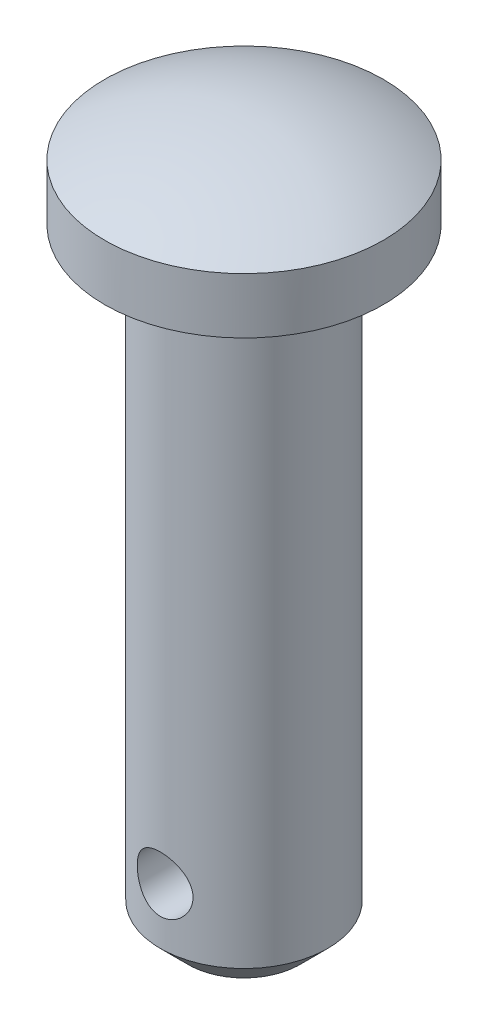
SolidWorks part; units mm, degrees
ref_plane "Front Plane" through (0, 0, 0) normal (0, 0, 1) x (1, 0, 0)
ref_plane "Top Plane" through (0, 0, 0) normal (0, 1, 0) x (1, 0, 0)
ref_plane "Right Plane" through (0, 0, 0) normal (1, 0, 0) x (0, 0, -1)
sketch "Sketch1" plane through (0, 0, 0) normal (0, 0, 1) x (1, 0, 0)
  line L0 (3.81, -4.2415) -> (6.35, -4.2415)
  line L1 (6.35, -4.2415) -> (6.35, -1.7015)
  line L2 (3.81, -4.2415) -> (3.81, -32.1815)
  line L4 (3.81, -32.1815) -> (0, -32.1815)
  line L5 (0, -32.1815) -> (0, 0)
  line L6 (0, 0) -> (0, 87.0293) construction
  arc A0 (0, 0) -> (6.35, -1.7015) centre (0, -12.7) cw
  dimension "D5" = 12.7
  dimension "D1" = 7.62
  dimension "D2" = 27.94
  dimension "D3" = 12.7
  dimension "D4" = 2.54
revolve "Revolve1" add sketch "Sketch1" angle 360 about L6
sketch "Sketch2" plane through (0, 0, 0) normal (0, 0, 1) x (1, 0, 0)
  line L0 (-6.35, -4.2415) -> (6.35, -4.2415) construction
  circle A0 centre (0, -28.3715) radius 1.27
  dimension "D2" = 2.54
  dimension "D1" = 22.86
extrude "Cut-Extrude1" cut sketch "Sketch2" against normal through all and the other way through all
chamfer "Chamfer1" distance 1.27 angle 45 1 edges at (0, -32.1815, -3.81)
